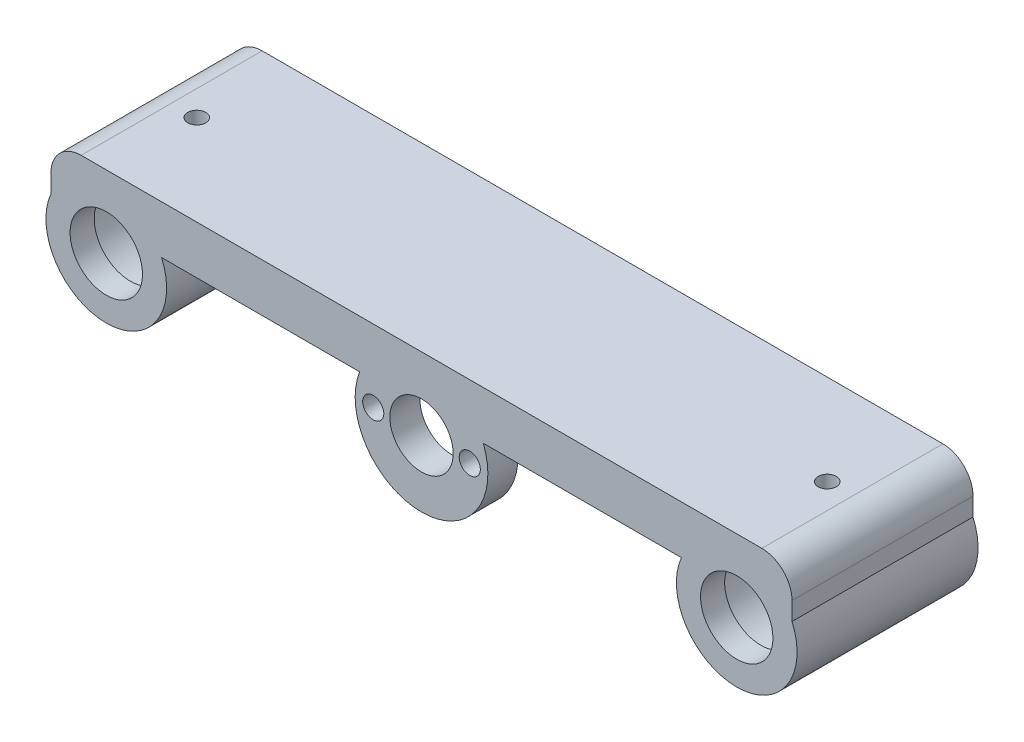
SolidWorks part; units mm, degrees
ref_plane "Front Plane" through (0, 0, 0) normal (0, 0, 1) x (1, 0, 0)
ref_plane "Top Plane" through (0, 0, 0) normal (0, 1, 0) x (1, 0, 0)
ref_plane "Right Plane" through (0, 0, 0) normal (1, 0, 0) x (0, 0, -1)
sketch "Sketch1" plane through (0, 0, 0) normal (0, 0, 1) x (1, 0, 0)
  line L1 (-9.1652, 4) -> (113.6652, 4)
  line L2 (-9.1652, 4) -> (-9.1652, 12)
  line L3 (-9.1652, 12) -> (113.6652, 12)
  line L4 (113.6652, 4) -> (113.6652, 12)
  circle A0 centre (0, 0) radius 7.75
  circle A1 centre (52.25, 0) radius 5.25
  circle A2 centre (104.5, 0) radius 7.75
  circle A3 centre (0, 0) radius 10
  circle A4 centre (52.25, 0) radius 11
  circle A5 centre (104.5, 0) radius 10
  circle A6 centre (44.25, 0) radius 1.75
  circle A7 centre (60.25, 0) radius 1.75
  point P18 (0, 0)
  dimension "D1" = 20
  dimension "D2" = 15.5
  dimension "D3" = 52.25
  dimension "D6" = 20
  dimension "D8" = 15.5
  dimension "D9" = 10.5
  dimension "D10" = 22
  dimension "D11" = 3.5
  dimension "D12" = 3.5
  dimension "D4" = 4
  dimension "D5" = 8
  dimension "D7" = 104.5
  dimension "D13" = 16
  dimension "D14" = 8
extrude "Boss-Extrude2" add sketch "Sketch1" along normal blind 30 contours L1 A4 A1 | L1 A4 A1 | L4 A5 L1 A2 | L1 A5 L4 A2 | L2 A3 L1 A0 | L1 A3 L2 A0 | A5 L4 L3 L2 A3 L1 A4
fillet "Fillet5" radius 5 2 edges at (113.6652, 12, 15) (-9.1652, 12, 15)
sketch "Sketch2" plane through (0, 0, 30) normal (0, 0, 1) x (1, 0, 0)
  circle A0 centre (0, 0) radius 7.75
  circle A1 centre (0, 0) radius 6
  circle A2 centre (104.5, 0) radius 7.75
  circle A3 centre (104.5, 0) radius 6
  dimension "D1" = 15.5
  dimension "D2" = 12
  dimension "D3" = 15.5
  dimension "D4" = 12
extrude "Boss-Extrude3" add sketch "Sketch2" against normal blind 4
sketch "Sketch3" plane through (0, 12, 0) normal (0, 1, 0) x (1, 0, 0)
  line L0 (-4.1652, 0) -> (108.6652, 0) construction
  circle A0 centre (0, -15) radius 1.5
  circle A1 centre (104.5, -15) radius 1.5
  dimension "D1" = 3
  dimension "D2" = 3
  dimension "D3" = 15
  dimension "D4" = 104.5
extrude "Cut-Extrude1" cut sketch "Sketch3" against normal up to next
sketch "Sketch5" plane through (0, 0, 0) normal (0, 0, -1) x (-1, 0, 0)
  line L0 (-62.497, 4) -> (-42.003, 4)
  arc A0 (-62.497, 4) -> (-42.003, 4) centre (-52.25, 0) ccw
extrude "Cut-Extrude3" cut sketch "Sketch5" against normal blind 25
